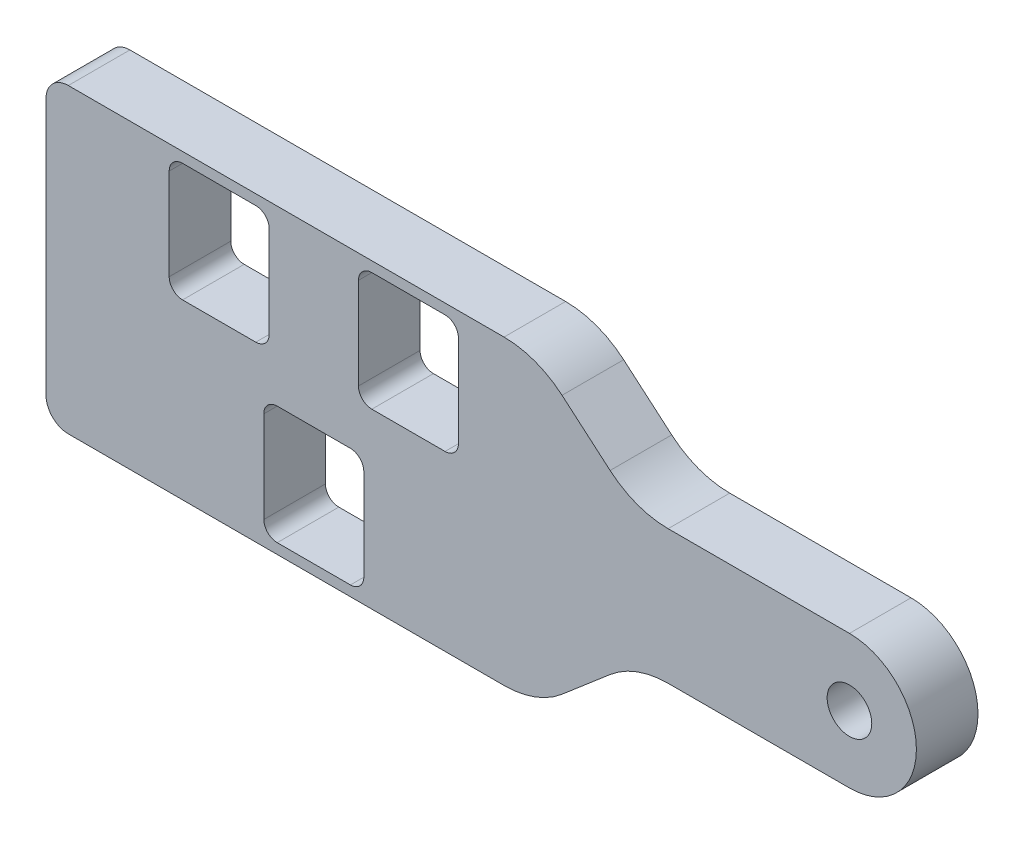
SolidWorks part; units mm, degrees
ref_plane "Front Plane" through (0, 0, 0) normal (0, 0, 1) x (1, 0, 0)
ref_plane "Top Plane" through (0, 0, 0) normal (0, 1, 0) x (1, 0, 0)
ref_plane "Right Plane" through (0, 0, 0) normal (1, 0, 0) x (0, 0, -1)
sketch "Sketch1" plane through (0, 0, 0) normal (0, 0, 1) x (1, 0, 0)
  line L0 (114.3, 30.988) -> (88.5028, 30.988)
  line L1 (3.175, 0) -> (65.1613, 0)
  line L2 (0, 3.175) -> (0, 39.751)
  line L3 (3.175, 42.926) -> (65.1613, 42.926)
  line L5 (114.3, 11.938) -> (88.5028, 11.938)
  line L6 (73.4139, 39.8792) -> (80.2502, 34.0348)
  line L7 (80.2502, 8.8912) -> (73.4139, 3.0468)
  circle A0 centre (114.3, 21.463) radius 3.175
  arc A1 (114.3, 11.938) -> (114.3, 30.988) centre (114.3, 21.463) ccw
  arc A2 (88.5028, 11.938) -> (80.2502, 8.8912) centre (88.5028, -0.762) ccw
  arc A3 (88.5028, 30.988) -> (80.2502, 34.0348) centre (88.5028, 43.688) cw
  arc A4 (73.4139, 39.8792) -> (65.1613, 42.926) centre (65.1613, 30.226) ccw
  arc A5 (73.4139, 3.0468) -> (65.1613, 0) centre (65.1613, 12.7) cw
  arc A6 (3.175, 42.926) -> (0, 39.751) centre (3.175, 39.751) ccw
  arc A7 (0, 3.175) -> (3.175, 0) centre (3.175, 3.175) ccw
  point P7 (69.85, 42.926)
  point P8 (69.85, 0)
  point P23 (0, 42.926)
  point P26 (0, 0)
  dimension "D5" = 12.7
  dimension "D4" = 12.7
  dimension "D6" = 12.7
  dimension "D7" = 3.175
  dimension "D8" = 3.175
  dimension "D1" = 42.926
  dimension "D2" = 114.3
  dimension "D3" = 21.463
extrude "Boss-Extrude1" add sketch "Sketch1" along normal blind 8.763
sketch "Sketch2" plane through (0, 0, 8.763) normal (0, 0, 1) x (1, 0, 0)
  line L0 (28.3087, 41.4655) -> (30.8487, 41.4655) construction
  line L1 (32.893, 18.288) -> (43.307, 18.288)
  line L2 (30.988, 16.383) -> (30.988, 3.3655)
  line L3 (32.893, 1.4605) -> (43.307, 1.4605)
  line L4 (45.212, 16.383) -> (45.212, 3.3655)
  line L5 (29.845, 41.4655) -> (19.431, 41.4655)
  line L6 (31.75, 39.5605) -> (31.75, 26.543)
  line L7 (29.845, 24.638) -> (19.431, 24.638)
  line L8 (17.526, 39.5605) -> (17.526, 26.543)
  line L9 (38.1, 52.4052) -> (38.1, -4.9836) construction
  line L10 (58.674, 39.5605) -> (58.674, 26.543)
  line L12 (46.355, 24.638) -> (56.769, 24.638)
  line L13 (44.45, 39.5605) -> (44.45, 26.543)
  line L14 (46.355, 41.4655) -> (56.769, 41.4655)
  line L17 (0, 39.751) -> (0, 3.175) construction
  line L19 (65.1613, 42.926) -> (3.175, 42.926) construction
  arc A0 (32.893, 18.288) -> (30.988, 16.383) centre (32.893, 16.383) ccw
  arc A1 (43.307, 18.288) -> (45.212, 16.383) centre (43.307, 16.383) cw
  arc A2 (43.307, 1.4605) -> (45.212, 3.3655) centre (43.307, 3.3655) ccw
  arc A3 (30.988, 3.3655) -> (32.893, 1.4605) centre (32.893, 3.3655) ccw
  arc A4 (19.431, 41.4655) -> (17.526, 39.5605) centre (19.431, 39.5605) ccw
  arc A5 (19.431, 24.638) -> (17.526, 26.543) centre (19.431, 26.543) cw
  arc A6 (31.75, 26.543) -> (29.845, 24.638) centre (29.845, 26.543) cw
  arc A7 (29.845, 41.4655) -> (31.75, 39.5605) centre (29.845, 39.5605) cw
  arc A8 (46.355, 41.4655) -> (44.45, 39.5605) centre (46.355, 39.5605) ccw
  arc A9 (44.45, 26.543) -> (46.355, 24.638) centre (46.355, 26.543) ccw
  arc A10 (56.769, 24.638) -> (58.674, 26.543) centre (56.769, 26.543) ccw
  arc A11 (56.769, 41.4655) -> (58.674, 39.5605) centre (56.769, 39.5605) cw
  point P27 (13.589, 24.638)
  point P30 (27.813, 24.638)
  point P33 (29.5787, 41.4655)
  point P44 (46.6213, 41.4655)
  point P45 (48.387, 24.638)
  dimension "D1" = 1.905
  dimension "D3" = 1.905
  dimension "D2" = 14.224
  dimension "D4" = 6.35
  dimension "D5" = 1.4605
  dimension "D6" = 38.1
extrude "Cut-Extrude1" cut sketch "Sketch2" against normal through all
